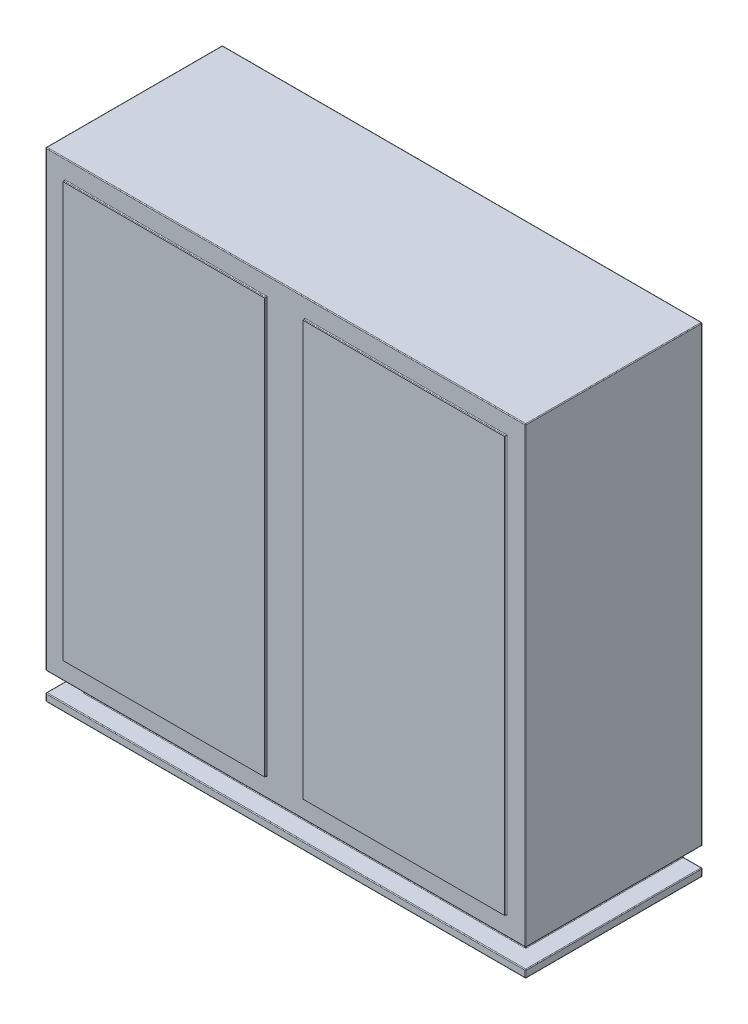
SolidWorks part; units mm, degrees
ref_plane "Plan de face" through (0, 0, 0) normal (0, 0, 1) x (1, 0, 0)
ref_plane "Plan de dessus" through (0, 0, 0) normal (0, 1, 0) x (1, 0, 0)
ref_plane "Plan de droite" through (0, 0, 0) normal (1, 0, 0) x (0, 0, -1)
sketch "Esquisse1" plane through (0, 0, 0) normal (1, 0, 0) x (0, 0, -1)
  line L0 (-230, 0) -> (230, 0)
  line L1 (230, 0) -> (230, 1250)
  line L2 (230, 1250) -> (-230, 1250)
  line L3 (-230, 0) -> (-230, 20)
  line L4 (-230, 20) -> (-180, 20)
  line L5 (-180, 20) -> (-180, 70)
  line L6 (-180, 70) -> (-230, 70)
  line L7 (-230, 70) -> (-230, 1250)
  dimension "D1" = 460
  dimension "D2" = 1180
  dimension "D4" = 20
  dimension "D5" = 50
  dimension "D6" = 50
extrude "Boss.-Extru.1" add sketch "Esquisse1" along normal mid plane 1250
sketch "Esquisse4" plane through (0, 0, 230) normal (0, 0, 1) x (1, 0, 0)
  line L0 (625, 20) -> (-625, 20) construction
  line L1 (-625, 70) -> (-575, 70)
  line L2 (-625, 70) -> (-625, 20)
  line L3 (-625, 20) -> (-575, 20)
  line L4 (-575, 70) -> (-575, 20)
  line L5 (625, 70) -> (-625, 70) construction
  line L6 (625, 20) -> (575, 20)
  line L7 (625, 20) -> (625, 70)
  line L8 (625, 70) -> (575, 70)
  line L9 (575, 20) -> (575, 70)
  dimension "D1" = 50
extrude "Enlèv. mat.-Extru.1" cut sketch "Esquisse4" against normal through all
sketch "Esquisse5" plane through (0, 0, 230) normal (0, 0, 1) x (1, 0, 0)
  line L0 (-625, 1250) -> (-625, 70) construction
  line L1 (-575, 1200) -> (-50, 1200)
  line L2 (-575, 1200) -> (-575, 120)
  line L3 (-575, 120) -> (-50, 120)
  line L4 (-50, 1200) -> (-50, 120)
  line L5 (50, 1200) -> (575, 1200)
  line L6 (50, 1200) -> (50, 120)
  line L7 (50, 120) -> (575, 120)
  line L8 (575, 1200) -> (575, 120)
  line L9 (625, 1250) -> (625, 70) construction
  line L10 (625, 1250) -> (-625, 1250) construction
  line L11 (625, 70) -> (-625, 70) construction
  dimension "D1" = 50
  dimension "D2" = 50
  dimension "D3" = 50
  dimension "D4" = 100
  dimension "D5" = 50
extrude "Boss.-Extru.2" add sketch "Esquisse5" along normal blind 5
fillet "Congé1" radius 2 44 edges at (625, 10, 230) (-625, 10, 230) (0, 0, 230) (625, 0, 0) (-625, 0, 0) (-575, 45, 180) (575, 45, 180) (-575, 20, -25) (0, 20, 180) (575, 20, -25) (625, 20, 0) (0, 20, 230) (-625, 20, 0) (-575, 70, -25) (575, 70, -25) (0, 70, 180) (312.5, 120, 230) (575, 660, 230) (312.5, 1200, 230) (50, 660, 230) (0, 70, 230) (-312.5, 120, 230) (-50, 660, 230) (-312.5, 1200, 230) (-575, 660, 230) (600, 70, -230) (-600, 70, -230) (-575, 45, -230) (-600, 20, -230) (-625, 10, -230) (0, 0, -230) (625, 10, -230) (600, 20, -230) (575, 45, -230) (-625, 660, 230) (-625, 70, 0) (-625, 660, -230) (625, 660, 230) (625, 660, -230) (625, 70, 0) (0, 1250, -230) (625, 1250, 0) (0, 1250, 230) (-625, 1250, 0)
